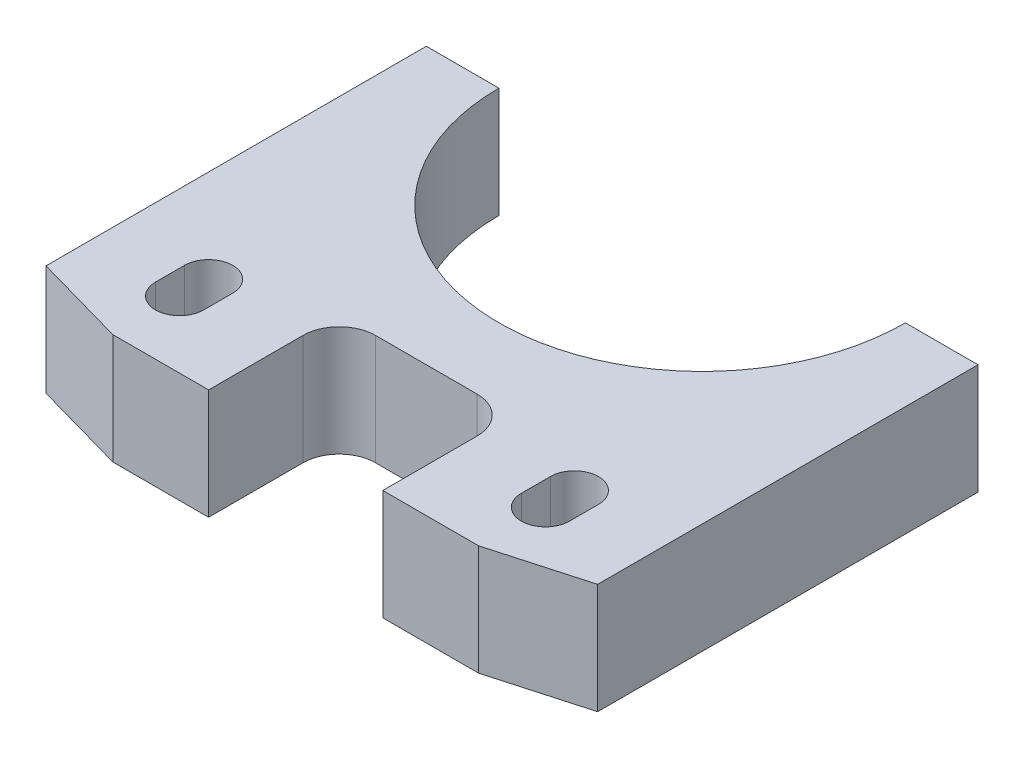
SolidWorks part; units mm, degrees
ref_plane "Front Plane" through (0, 0, 0) normal (0, 0, 1) x (1, 0, 0)
ref_plane "Top Plane" through (0, 0, 0) normal (0, 1, 0) x (1, 0, 0)
ref_plane "Right Plane" through (0, 0, 0) normal (1, 0, 0) x (0, 0, -1)
sketch "Sketch1" plane through (0, 0, 0) normal (0, 1, 0) x (1, 0, 0)
  line L0 (0, 0) -> (0, -58.42) construction
  line L1 (18.1102, -52.578) -> (18.1102, -50.038)
  line L2 (-16.002, -58.42) -> (-24.13, -56.134)
  line L3 (7.62, -58.42) -> (16.002, -58.42)
  line L4 (24.13, -22.86) -> (24.13, -56.134)
  line L5 (7.62, -58.42) -> (7.62, -50.165)
  line L6 (4.445, -46.99) -> (-4.445, -46.99)
  line L7 (13.8938, -52.578) -> (13.8938, -50.038)
  line L8 (-7.62, -58.42) -> (-7.62, -50.165)
  line L9 (-24.13, -22.86) -> (-24.13, -56.134)
  line L10 (-13.8938, -52.578) -> (-13.8938, -50.038)
  line L11 (16.002, -58.42) -> (24.13, -56.134)
  line L12 (-7.62, -58.42) -> (-16.002, -58.42)
  line L13 (-18.1102, -52.578) -> (-18.1102, -50.038)
  line L14 (17.78, -22.86) -> (24.13, -22.86)
  line L15 (-17.78, -22.86) -> (-24.13, -22.86)
  line L16 (-16.002, -50.038) -> (-16.002, -52.578) construction
  line L17 (16.002, -50.038) -> (16.002, -52.578) construction
  arc A0 (7.62, -50.165) -> (4.445, -46.99) centre (4.445, -50.165) ccw
  arc A1 (-17.78, -22.86) -> (17.78, -22.86) centre (0, -22.86) ccw
  arc A2 (-7.62, -50.165) -> (-4.445, -46.99) centre (-4.445, -50.165) cw
  arc A3 (18.1102, -50.038) -> (13.8938, -50.038) centre (16.002, -50.038) ccw
  arc A4 (13.8938, -52.578) -> (18.1102, -52.578) centre (16.002, -52.578) ccw
  arc A5 (-13.8938, -52.578) -> (-18.1102, -52.578) centre (-16.002, -52.578) cw
  arc A6 (-18.1102, -50.038) -> (-13.8938, -50.038) centre (-16.002, -50.038) cw
  point P20 (0, -46.99)
  point P32 (-16.002, -51.308)
  point P33 (16.002, -51.308)
  dimension "D5" = 2.1082
  dimension "D4" = 33.274
  dimension "D1" = 2.54
  dimension "D2" = 17.78
  dimension "D6" = 27.178
  dimension "D7" = 16.002
  dimension "D9" = 3.175
  dimension "D14" = 22.86
  dimension "D19" = 2.1082
  dimension "D21" = 5.842
  dimension "D3" = 6.35
  dimension "D8" = 8.255
  dimension "D10" = 8.89
  dimension "D11" = 2.286
  dimension "D12" = 8.128
  dimension "D13" = 8.382
  dimension "D15" = 22.86
  dimension "D16" = 6.35
  dimension "D17" = 33.274
  dimension "D18" = 24.13
  dimension "D20" = 4.2164
extrude "Extrude1" add sketch "Sketch1" along normal blind 9.652
sketch "Sketch2" plane through (0, 0, 22.86) normal (0, 0, -1) x (-1, 0, 0)
  circle A0 centre (-20.828, 4.826) radius 1.3589
  circle A1 centre (20.828, 4.826) radius 1.3589
extrude "Cut-Extrude1" cut sketch "Sketch2" against normal blind 10.922
sketch "Sketch3" plane through (0, 0, 0) normal (0, -1, 0) x (1, 0, 0)
  line L0 (16.002, 50.038) -> (16.002, 52.578) construction
  line L1 (0, 22.86) -> (0, 57.955) construction
  circle A0 centre (16.002, 51.308) radius 2.1082
  circle A1 centre (-16.002, 51.308) radius 2.1082
